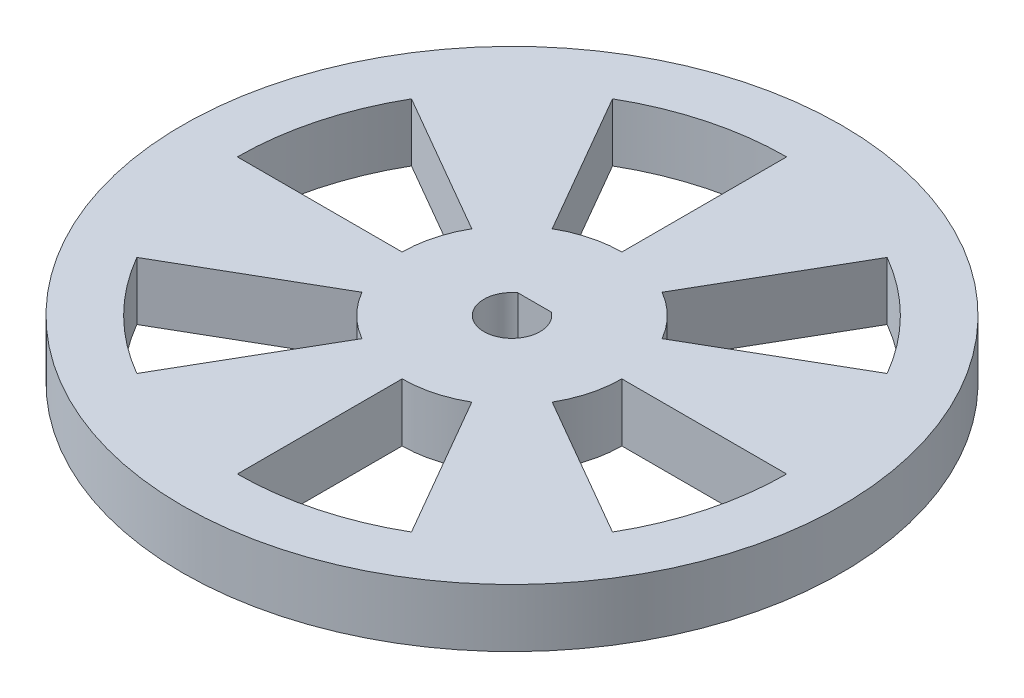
SolidWorks part; units mm, degrees
ref_plane "Front Plane" through (0, 0, 0) normal (0, 0, 1) x (1, 0, 0)
ref_plane "Top Plane" through (0, 0, 0) normal (0, 1, 0) x (1, 0, 0)
ref_plane "Right Plane" through (0, 0, 0) normal (1, 0, 0) x (0, 0, -1)
sketch "Sketch1" plane through (0, 0, 0) normal (0, 1, 0) x (1, 0, 0)
  line L0 (0, -12) -> (0, -30)
  line L1 (-6, 10.3923) -> (-15, 25.9808)
  line L2 (-10.3923, 6) -> (-25.9808, 15)
  line L3 (-12, 0) -> (-30, 0)
  line L4 (1.8319, 2.4636) -> (-1.8319, 2.4636)
  line L5 (10.3923, 6) -> (25.9808, 15)
  line L6 (6, 10.3923) -> (15, 25.9808)
  line L7 (0, 12) -> (0, 30)
  line L8 (6, -10.3923) -> (15, -25.9808)
  line L9 (10.3923, -6) -> (25.9808, -15)
  line L10 (12, 0) -> (30, 0)
  line L11 (-10.3923, -6) -> (-25.9808, -15)
  line L12 (-6, -10.3923) -> (-15, -25.9808)
  arc A0 (10.3923, -6) -> (12, 0) centre (0, 0) ccw
  arc A1 (-1.8319, 2.4636) -> (1.8319, 2.4636) centre (0, 0) ccw
  circle A2 centre (0, 0) radius 36
  arc A3 (0, -30) -> (15, -25.9808) centre (0, 0) ccw
  arc A4 (25.9808, -15) -> (30, 0) centre (0, 0) ccw
  arc A5 (25.9808, 15) -> (15, 25.9808) centre (0, 0) ccw
  arc A6 (0, -12) -> (6, -10.3923) centre (0, 0) ccw
  arc A7 (-10.3923, -6) -> (-6, -10.3923) centre (0, 0) ccw
  arc A8 (-25.9808, -15) -> (-15, -25.9808) centre (0, 0) ccw
  arc A9 (-10.3923, 6) -> (-12, 0) centre (0, 0) ccw
  arc A10 (-25.9808, 15) -> (-30, 0) centre (0, 0) ccw
  arc A11 (0, 30) -> (-15, 25.9808) centre (0, 0) ccw
  arc A12 (0, 12) -> (-6, 10.3923) centre (0, 0) ccw
  arc A13 (10.3923, 6) -> (6, 10.3923) centre (0, 0) ccw
  dimension "D1" = 2.4636
  dimension "D2" = 3.07
  dimension "D3" = 72
  dimension "D4" = 30
  dimension "D5" = 12
extrude "Extrude1" add sketch "Sketch1" along normal blind 6.35
